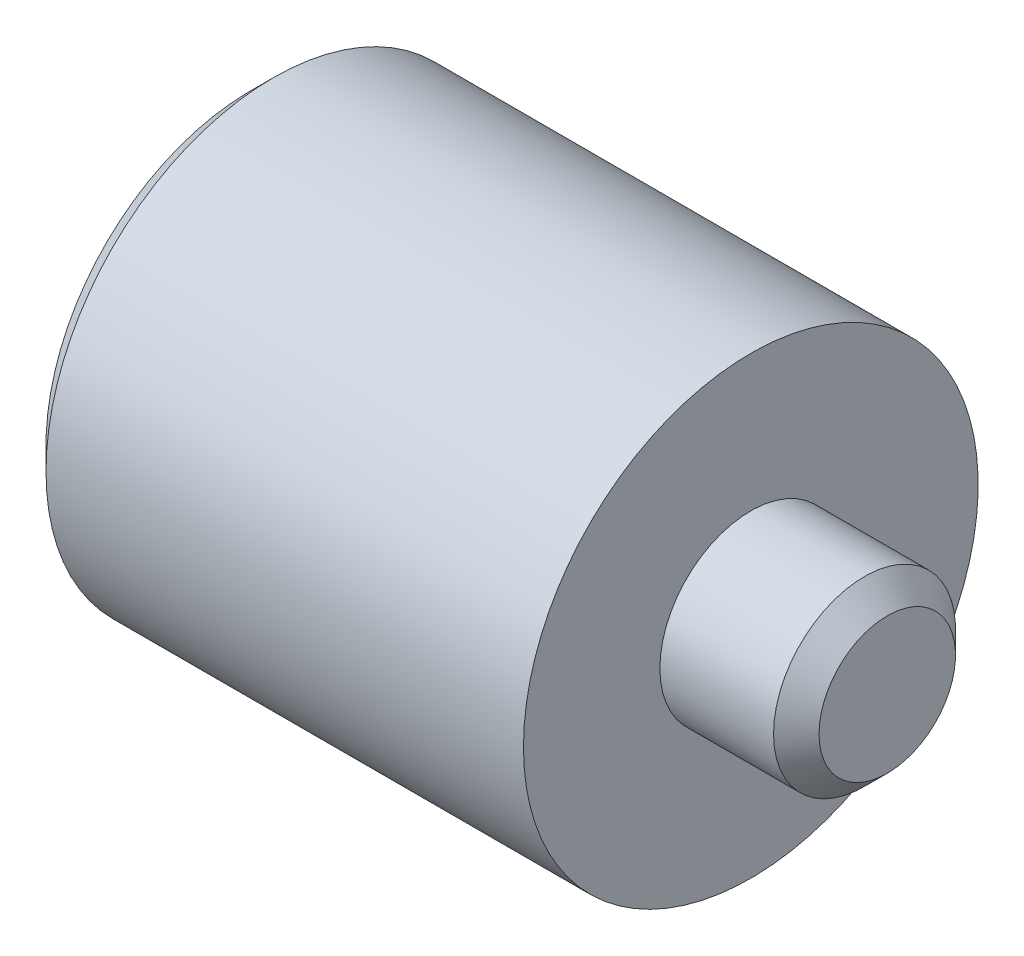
SolidWorks part; units mm, degrees
ref_plane "Face" through (0, 0, 0) normal (0, 0, 1) x (1, 0, 0)
ref_plane "Dessus" through (0, 0, 0) normal (0, 1, 0) x (1, 0, 0)
ref_plane "Droite" through (0, 0, 0) normal (1, 0, 0) x (0, 0, -1)
sketch "Esquisse1" plane through (0, 0, 0) normal (0, 0, 1) x (1, 0, 0)
  line L0 (-13.0085, 0) -> (75.9772, 0) construction
  line L1 (0, 0) -> (0, 5)
  line L2 (0, 5) -> (11, 5)
  line L3 (11, 5) -> (11, 2)
  line L4 (11, 2) -> (14, 2)
  line L5 (14, 2) -> (14, 0)
  line L6 (14, 0) -> (0, 0)
  dimension "D1" = 3
  dimension "D2" = 11
  dimension "D3" = 2
  dimension "D4" = 5
revolve "Base-Révolution" add sketch "Esquisse1" angle 360 about L0
chamfer "Chanfrein1" distance 0.5 angle 45
